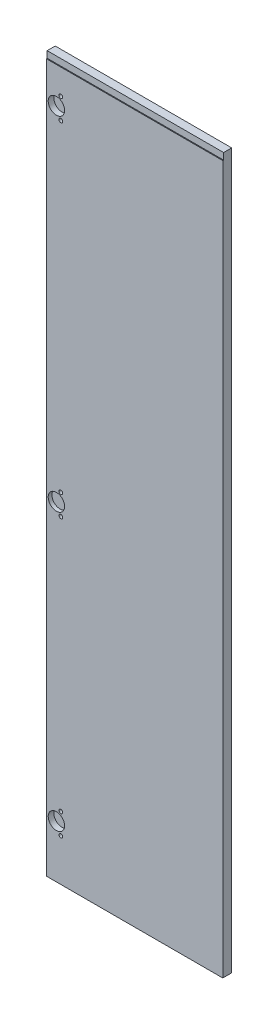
SolidWorks part; units mm, degrees
ref_plane "Ebene vorne" through (0, 0, 0) normal (0, 0, 1) x (1, 0, 0)
ref_plane "Ebene oben" through (0, 0, 0) normal (0, 1, 0) x (1, 0, 0)
ref_plane "Ebene rechts" through (0, 0, 0) normal (1, 0, 0) x (0, 0, -1)
sketch "Skizze1" plane through (0, 0, 0) normal (0, 0, 1) x (1, 0, 0)
  line L1 (-188.25, -762.3) -> (188.25, -762.3)
  line L2 (-188.25, -762.3) -> (-188.25, 762.3)
  line L3 (-188.25, 762.3) -> (188.25, 762.3)
  line L4 (188.25, -762.3) -> (188.25, 762.3)
  line L5 (-188.25, -762.3) -> (188.25, 762.3) construction
  line L6 (-188.25, 762.3) -> (188.25, -762.3) construction
  point P0 (0, 0)
  dimension "D1" = 376.5
  dimension "D2" = 1524.6
extrude "Aufsatz-Linear austragen1" add sketch "Skizze1" along normal blind 19
sketch "Skizze5" plane through (0, 0, 19) normal (0, 0, 1) x (1, 0, 0)
  line L0 (-188.25, 762.3) -> (-188.25, -762.3) construction
  line L1 (-188.25, -762.3) -> (188.25, -762.3) construction
  line L2 (188.25, 762.3) -> (-188.25, 762.3) construction
  line L3 (-62.8755, 672) -> (-293.9472, 672) construction
  line L4 (-166.75, -649.8) -> (-73.1839, -649.8) construction
  circle A0 centre (-166.75, 672) radius 17.5
  circle A1 centre (-166.75, -649.8) radius 17.5
  dimension "D4" = 35
  dimension "D1" = 21.5
  dimension "D2" = 112.5
  dimension "D3" = 90.3
extrude "Schnitt-Linear austragen1 Topfband" cut sketch "Skizze5" against normal blind 12
hole_wizard "Ø8.0 (8) Durchmesser Bohrung1 Topfband" positions "Skizze7" profile "Skizze6" hole size "Ø8.0" standard "Din"
sketch "Skizze7" plane through (0, 0, 19) normal (0, 0, 1) x (1, 0, 0)
  line L0 (-188.25, 762.3) -> (-188.25, -762.3) construction
  line L3 (188.25, 762.3) -> (-188.25, 762.3) construction
  line L4 (-188.25, -762.3) -> (188.25, -762.3) construction
  circle A1 centre (-166.75, 672) radius 17.5 construction
  circle A2 centre (-166.75, -649.8) radius 17.5 construction
  point P0 (-157.25, 694.5)
  point P2 (-157.25, 649.5)
  point P4 (-157.25, -627.3)
  point P6 (-157.25, -672.3)
  dimension "D4" = 22.5
  dimension "D7" = 22.5
  dimension "D1" = 31
  dimension "D2" = 45
  dimension "D3" = 67.8
  dimension "D5" = 45
  dimension "D6" = 90
sketch "Skizze6" plane through (-157.25, 694.5, 19) normal (1, 0, 0) x (0, -1, 0)
  line L0 (0, 0) -> (0, 9.4034)
  line L1 (0, 9.4034) -> (4, 7)
  line L2 (4, 7) -> (4, 0)
  line L5 (4, 0) -> (0, 0)
  line L10 (0, 9.4034) -> (-4, 7) construction
  line L11 (0, -6.35) -> (0, 107.95) construction
  dimension "Bohrerdurchmesser" = 8
  dimension "Bohrungstiefe" = 7
  dimension "Spitzenwinkel" = 118
sketch "Skizze8" plane through (-188.25, 0, 0) normal (-1, 0, 0) x (0, 0, 1)
  line L0 (17.2, 762.3) -> (17.2, 748.3)
  line L1 (19, 762.3) -> (0, 762.3) construction
  line L2 (17.2, 748.3) -> (19, 748.3)
  line L3 (19, 762.3) -> (19, -762.3) construction
  line L4 (19, 748.3) -> (19, 762.3)
  line L5 (19, 762.3) -> (17.2, 762.3)
  dimension "D1" = 1.8
  dimension "D2" = 14
extrude "Schnitt-Linear austragen2" cut sketch "Skizze8" against normal through all
sketch "Skizze9" plane through (0, 0, 19) normal (0, 0, 1) x (1, 0, 0)
  line L0 (-188.25, 748.3) -> (-188.25, -762.3) construction
  line L1 (-188.25, -762.3) -> (188.25, -762.3) construction
  line L2 (-166.75, -59.8) -> (-91.2105, -59.8) construction
  circle A0 centre (-166.75, -59.8) radius 17.5
  dimension "D1" = 35
  dimension "D2" = 21.5
  dimension "D3" = 702.5
extrude "Schnitt-Linear austragen3 Topfb >3OH" cut sketch "Skizze9" against normal blind 8
hole_wizard "Ø8.0 (8) Bohrung2 Topfb >3OH " positions "Skizze11" profile "Skizze10" hole size "Ø8.0" standard "Din"
sketch "Skizze11" plane through (0, 0, 19) normal (0, 0, 1) x (1, 0, 0)
  line L0 (-166.75, -59.8) -> (-63.1073, -59.8) construction
  line L1 (-188.25, 748.3) -> (-188.25, -762.3) construction
  point P0 (-157.25, -37.3)
  point P2 (-157.25, -82.3)
  dimension "D1" = 45
  dimension "D2" = 31
sketch "Skizze10" plane through (-157.25, -37.3, 19) normal (1, 0, 0) x (0, -1, 0)
  line L0 (0, 0) -> (0, 9.4034)
  line L1 (0, 9.4034) -> (4, 7)
  line L2 (4, 7) -> (4, 0)
  line L5 (4, 0) -> (0, 0)
  line L10 (0, 9.4034) -> (-4, 7) construction
  line L11 (0, -6.35) -> (0, 107.95) construction
  dimension "Bohrerdurchmesser" = 8
  dimension "Bohrungstiefe" = 7
  dimension "Spitzenwinkel" = 118
